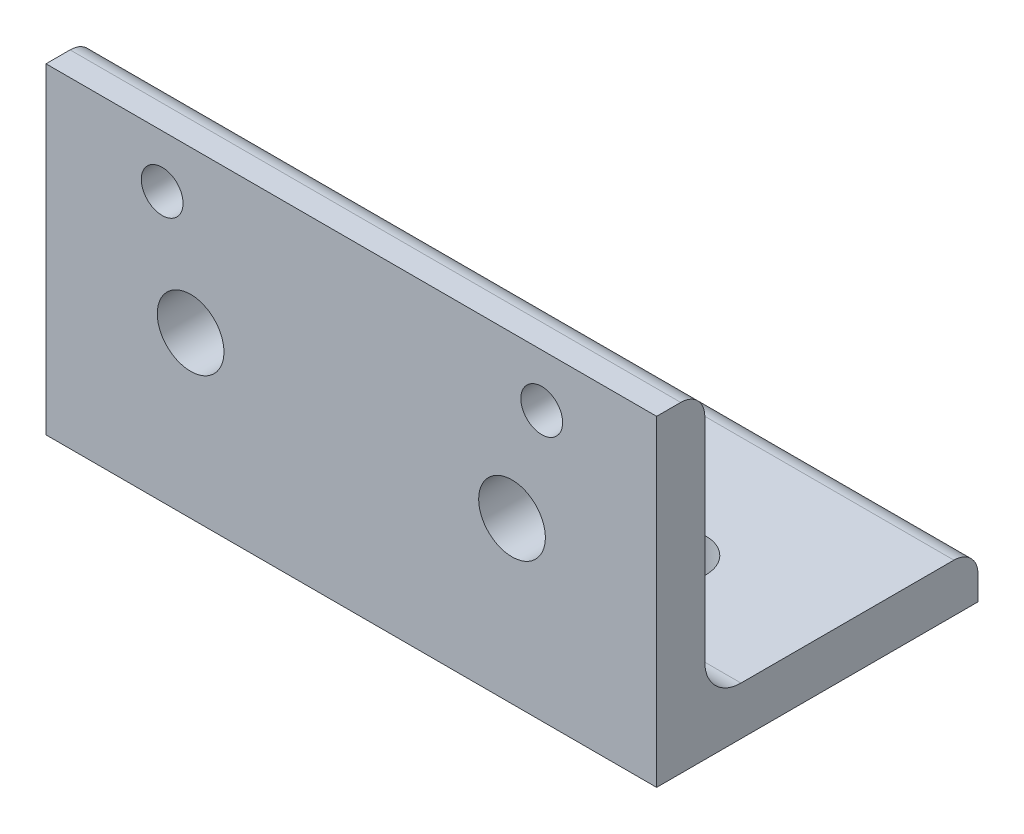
SolidWorks part; units mm, degrees
ref_plane "Front Plane" through (0, 0, 0) normal (0, 0, 1) x (1, 0, 0)
ref_plane "Top Plane" through (0, 0, 0) normal (0, 1, 0) x (1, 0, 0)
ref_plane "Right Plane" through (0, 0, 0) normal (1, 0, 0) x (0, 0, -1)
sketch "Sketch1" plane through (0, 0, 0) normal (0, 0, 1) x (1, 0, 0)
  line L0 (76, 0) -> (76, 40)
  line L1 (76, 40) -> (0, 40)
  line L2 (0, 40) -> (0, 0)
  line L3 (0, 0) -> (76, 0)
  dimension "D1" = 76
  dimension "D2" = 40
extrude "Boss-Extrude1" add sketch "Sketch1" against normal blind 40
sketch "Sketch2" plane through (76, 0, 0) normal (1, 0, 0) x (0, 0, -1)
  line L0 (6, 6) -> (40, 6)
  line L1 (40, 6) -> (40, 40)
  line L2 (40, 40) -> (6, 40)
  line L3 (6, 40) -> (6, 6)
  line L4 (0, 0) -> (0, 40) construction
  line L5 (40, 0) -> (0, 0) construction
  dimension "D1" = 6
  dimension "D2" = 40
  dimension "D3" = 6
  dimension "D4" = 40
extrude "Cut-Extrude1" cut sketch "Sketch2" against normal through all
hole_wizard "Ø8.3 (8.3) Diameter Hole1" positions "Sketch4" profile "Sketch3" hole size "Ø8.3" standard "ANSI Metric"
sketch "Sketch4" plane through (0, 6, 0) normal (0, 1, 0) x (1, 0, 0)
  point P0 (18, 20)
  point P1 (58, 20)
sketch "Sketch3" plane through (18, 6, -20) normal (1, 0, 0) x (0, 0, 1)
  line L0 (0, 0) -> (0, 6)
  line L1 (0, 6) -> (4.15, 6)
  line L2 (4.15, 6) -> (4.15, 0)
  line L5 (4.15, 0) -> (0, 0)
  line L11 (0, -6.35) -> (0, 107.95) construction
  dimension "Thru Hole Dia." = 8.3
  dimension "Thru Hole Depth" = 6
hole_wizard "Ø8.3 (8.3) Diameter Hole2" positions "Sketch6" profile "Sketch5" hole size "Ø8.3" standard "ANSI Metric"
sketch "Sketch6" plane through (0, 0, -6) normal (0, 0, -1) x (-1, 0, 0)
  point P0 (-58, 20)
  point P1 (-18, 20)
sketch "Sketch5" plane through (58, 20, -6) normal (1, 0, 0) x (0, 1, 0)
  line L0 (0, 0) -> (0, 6)
  line L1 (0, 6) -> (4.15, 6)
  line L2 (4.15, 6) -> (4.15, 0)
  line L5 (4.15, 0) -> (0, 0)
  line L11 (0, -6.35) -> (0, 107.95) construction
  dimension "Thru Hole Dia." = 8.3
  dimension "Thru Hole Depth" = 6
fillet "Fillet1" radius 4.5 1 edges at (38, 6, -6)
fillet "Fillet2" radius 3 2 edges at (38, 6, -40) (38, 40, -6)
sketch "Sketch7" plane through (0, 0, 0) normal (0, 0, 1) x (1, 0, 0)
  circle A0 centre (14.4596, 33.476) radius 2.6
  circle A1 centre (61.6996, 33.476) radius 2.6
extrude "Cut-Extrude2" cut sketch "Sketch7" against normal through all
